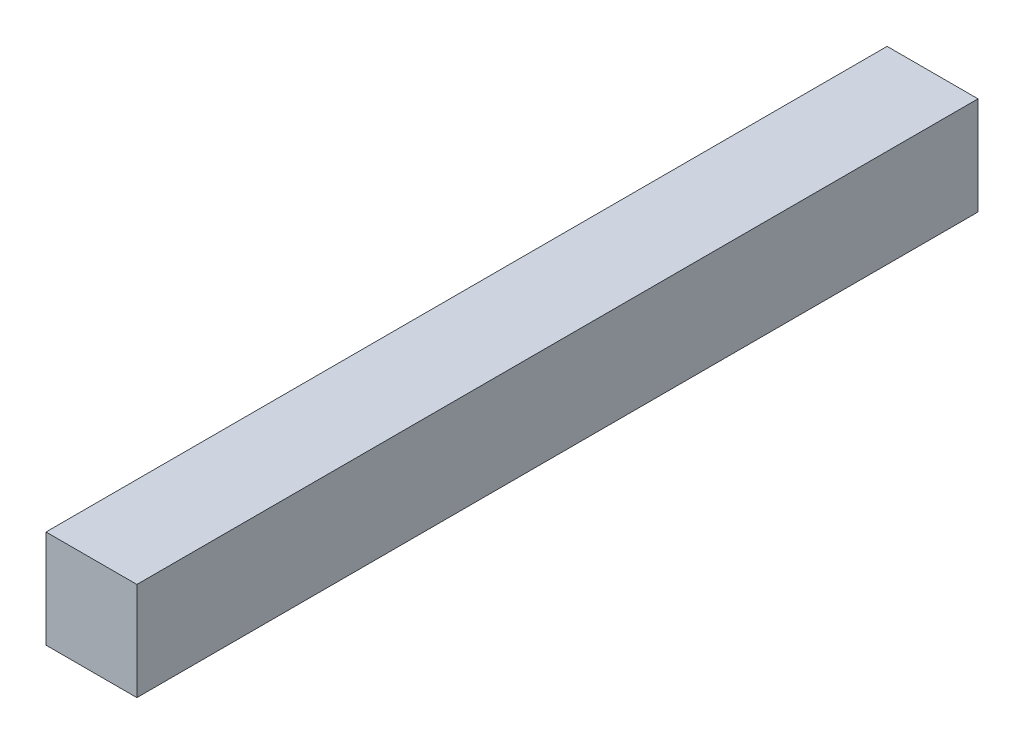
SolidWorks part; units mm, degrees
ref_plane "Front Plane" through (0, 0, 0) normal (0, 0, 1) x (1, 0, 0)
ref_plane "Top Plane" through (0, 0, 0) normal (0, 1, 0) x (1, 0, 0)
ref_plane "Right Plane" through (0, 0, 0) normal (1, 0, 0) x (0, 0, -1)
sketch "Sketch1" plane through (0, 0, 0) normal (0, 0, 1) x (1, 0, 0)
  line L1 (3.8148, -4.1155) -> (-3.8148, -4.1155)
  line L2 (3.8148, -4.1155) -> (3.8148, 4.1155)
  line L3 (3.8148, 4.1155) -> (-3.8148, 4.1155)
  line L4 (-3.8148, -4.1155) -> (-3.8148, 4.1155)
  line L5 (3.8148, -4.1155) -> (-3.8148, 4.1155) construction
  line L6 (3.8148, 4.1155) -> (-3.8148, -4.1155) construction
  point P0 (0, 0)
extrude "Boss-Extrude1" add sketch "Sketch1" along normal up to surface (70.6155 mm away)
